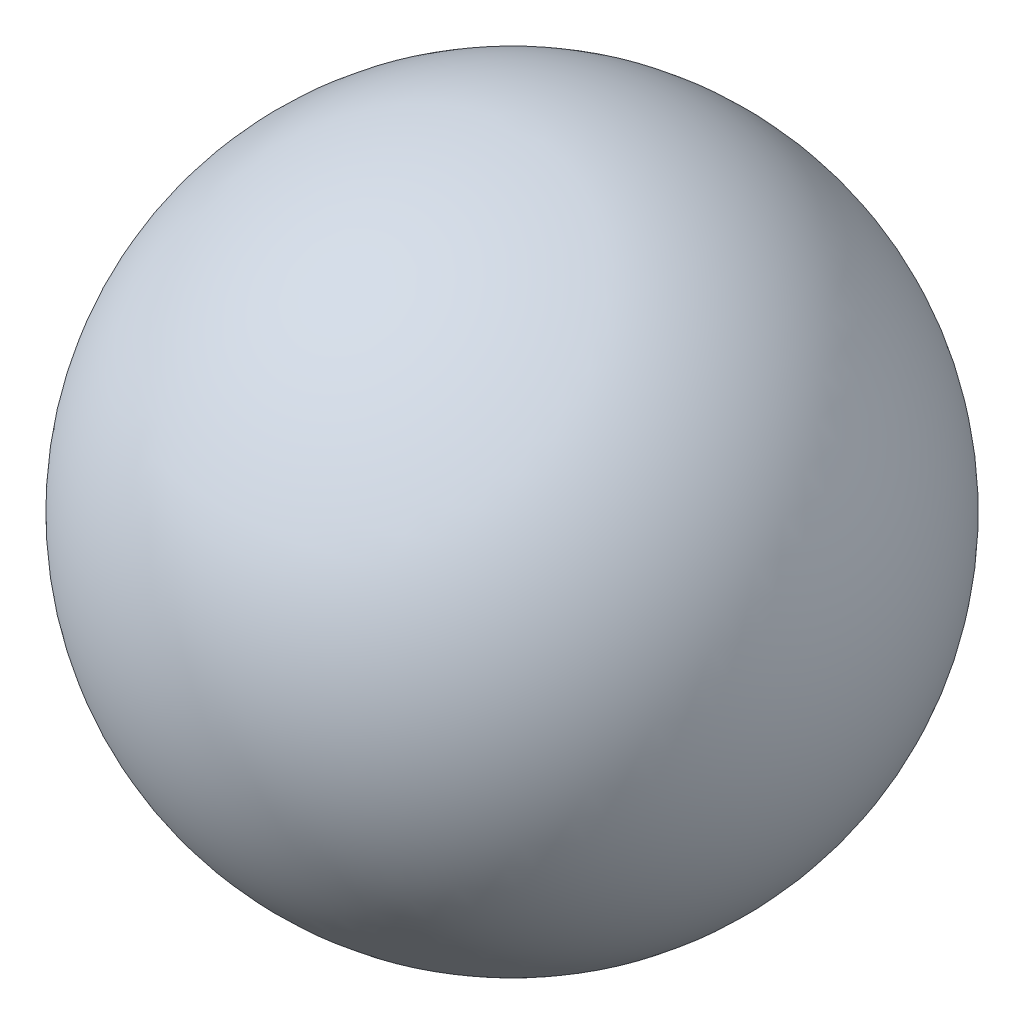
SolidWorks part; units mm, degrees
ref_plane "Plan1" through (0, 0, 0) normal (0, 0, 1) x (1, 0, 0)
ref_plane "Plan2" through (0, 0, 0) normal (0, 1, 0) x (1, 0, 0)
ref_plane "Plan3" through (0, 0, 0) normal (1, 0, 0) x (0, 0, -1)
sketch "Esquisse1" plane through (0, 0, 0) normal (1, 0, 0) x (0, 0, -1)
  line L1 (0, 2.25) -> (0, -2.25)
  line L2 (0, 2.25) -> (0, 11) construction
  arc A0 (0, 2.25) -> (0, -2.25) centre (0, 0) ccw
  dimension "D1" = 4.5
revolve "Base-Révolution" add sketch "Esquisse1" angle 360 about L2
